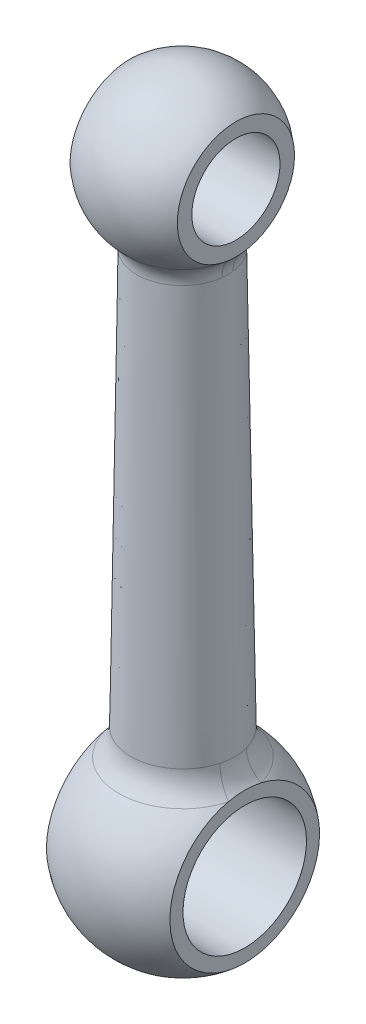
SolidWorks part; units mm, degrees
ref_plane "Front Plane" through (0, 0, 0) normal (0, 0, 1) x (1, 0, 0)
ref_plane "Top Plane" through (0, 0, 0) normal (0, 1, 0) x (1, 0, 0)
ref_plane "Right Plane" through (0, 0, 0) normal (1, 0, 0) x (0, 0, -1)
sketch "Sketch1" plane through (0, 0, 0) normal (0, 0, 1) x (1, 0, 0)
  line L1 (0.0072, -5.5) -> (-0.05, 38)
  line L2 (-2.6092, 29.7986) -> (-2.965, 4.6324)
  arc A0 (0.0072, -5.5) -> (-2.965, 4.6324) centre (0, 0) cw
  arc A1 (-2.6092, 29.7986) -> (-0.05, 38) centre (-0.05, 33.5) cw
  dimension "D1" = 5.5
  dimension "D2" = 4.5
  dimension "D3" = 33.5
  dimension "D5" = 2.57
revolve "Revolve1" add sketch "Sketch1" angle 360 about L1
sketch "Sketch2" plane through (0, 0, 0) normal (0, 0, 1) x (1, 0, 0)
  line L0 (0, -8.7126) -> (0, 41.9187) construction
  line L1 (-3, 38.6704) -> (-3, 28.2193)
  line L2 (-3, 28.2193) -> (-5, 28.2193)
  line L3 (-5, 28.2193) -> (-5, 38.6704)
  line L4 (-5, 38.6704) -> (-3, 38.6704)
  line L5 (-3.5, 4.4219) -> (-3.5, -4.6169)
  line L6 (-3.5, -4.6169) -> (-6, -4.6169)
  line L7 (-6, -4.6169) -> (-6, 4.4219)
  line L8 (-6, 4.4219) -> (-3.5, 4.4219)
  line L9 (3.5, -4.6169) -> (6, -4.6169)
  line L10 (6, -4.6169) -> (6, 4.4219)
  line L11 (3.5, 4.4219) -> (3.5, -4.6169)
  line L12 (6, 4.4219) -> (3.5, 4.4219)
  line L13 (3, 28.2193) -> (5, 28.2193)
  line L14 (3, 38.6704) -> (3, 28.2193)
  line L15 (5, 28.2193) -> (5, 38.6704)
  line L16 (5, 38.6704) -> (3, 38.6704)
  dimension "D1" = 3
  dimension "D2" = 3.5
  dimension "D3" = 2.5
  dimension "D4" = 2
extrude "Cut-Extrude1" cut sketch "Sketch2" against normal mid plane 10
sketch "Sketch3" plane through (0, 0, 0) normal (1, 0, 0) x (0, 0, -1)
  circle A0 centre (0, 33.5) radius 2.5
  circle A1 centre (0, 0) radius 3.5
  dimension "D1" = 7
  dimension "D2" = 5
  dimension "D3" = 33.5
extrude "Cut-Extrude2" cut sketch "Sketch3" against normal mid plane 10
fillet "Fillet2" radius 1.5 1 edges at (2.5308, 29.8054, 0)
fillet "Fillet3" radius 2 1 edges at (2.9528, 4.6401, 0)
